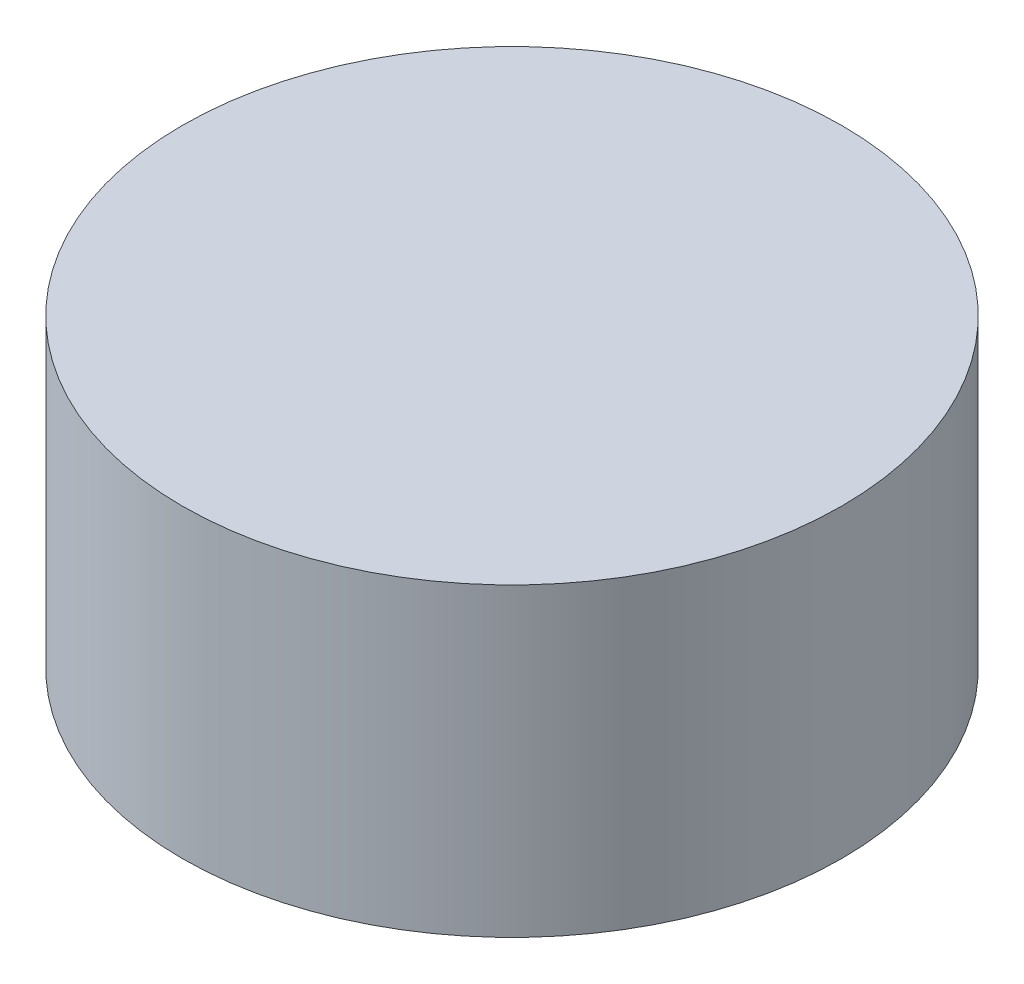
SolidWorks part; units mm, degrees
ref_plane "Front Plane" through (0, 0, 0) normal (0, 0, 1) x (1, 0, 0)
ref_plane "Top Plane" through (0, 0, 0) normal (0, 1, 0) x (1, 0, 0)
ref_plane "Right Plane" through (0, 0, 0) normal (1, 0, 0) x (0, 0, -1)
sketch "Sketch1" plane through (0, 0, 0) normal (0, 1, 0) x (1, 0, 0)
  circle A0 centre (0, 0) radius 0.325
  dimension "D1" = 0.65
extrude "Boss-Extrude1" add sketch "Sketch1" along normal mid plane 2.82
sketch "Sketch2" plane through (0, 1.41, 0) normal (0, 1, 0) x (1, 0, 0)
  circle A0 centre (0, 0) radius 0.54
  dimension "D1" = 1.08
extrude "Boss-Extrude2" add sketch "Sketch2" along normal blind 0.5
sketch "Sketch4" plane through (0, 0, 0) normal (1, 0, 0) x (0, 0, -1)
  line L0 (0, -1.41) -> (0, 18.34) construction
  line L1 (-0.325, -1.41) -> (0.325, -1.41) construction
  line L2 (0, 18.34) -> (19.7527, 18.34) construction
  circle A0 centre (0, 18.34) radius 19.7527 construction
  dimension "D1" = 19.75
sketch "Sketch5" plane through (0, 0, 0) normal (1, 0, 0) x (0, 0, -1)
  line L0 (0, -1.41) -> (0, -1.61)
  line L1 (0, -1.41) -> (0, -0.41) construction
  line L2 (0, -1.41) -> (0, 18.34) construction
  line L3 (0.4872, -1.5067) -> (0.4872, -1.4067)
  line L4 (0, -1.41) -> (0.325, -1.41)
  circle A0 centre (0, 18.34) radius 19.7527 construction
  arc A1 (0.325, -1.41) -> (0.4872, -1.4067) centre (0, 18.34) ccw
  arc A2 (0, -1.61) -> (0.4872, -1.5067) centre (0, -0.41) ccw
  dimension "D1" = 0.2
  dimension "D2" = 1
  dimension "D4" = 0.1
revolve "Revolve1" add sketch "Sketch5" angle 360 about L1
sketch "Sketch7" plane through (0, 1.41, 0) normal (0, -1, 0) x (1, 0, 0)
  circle A1 centre (0, 0) radius 0.54
  circle A2 centre (0, 0) radius 0.54
  dimension "D1" = 0
extrude "Cut-Extrude1" cut sketch "Sketch7" along normal blind 10
